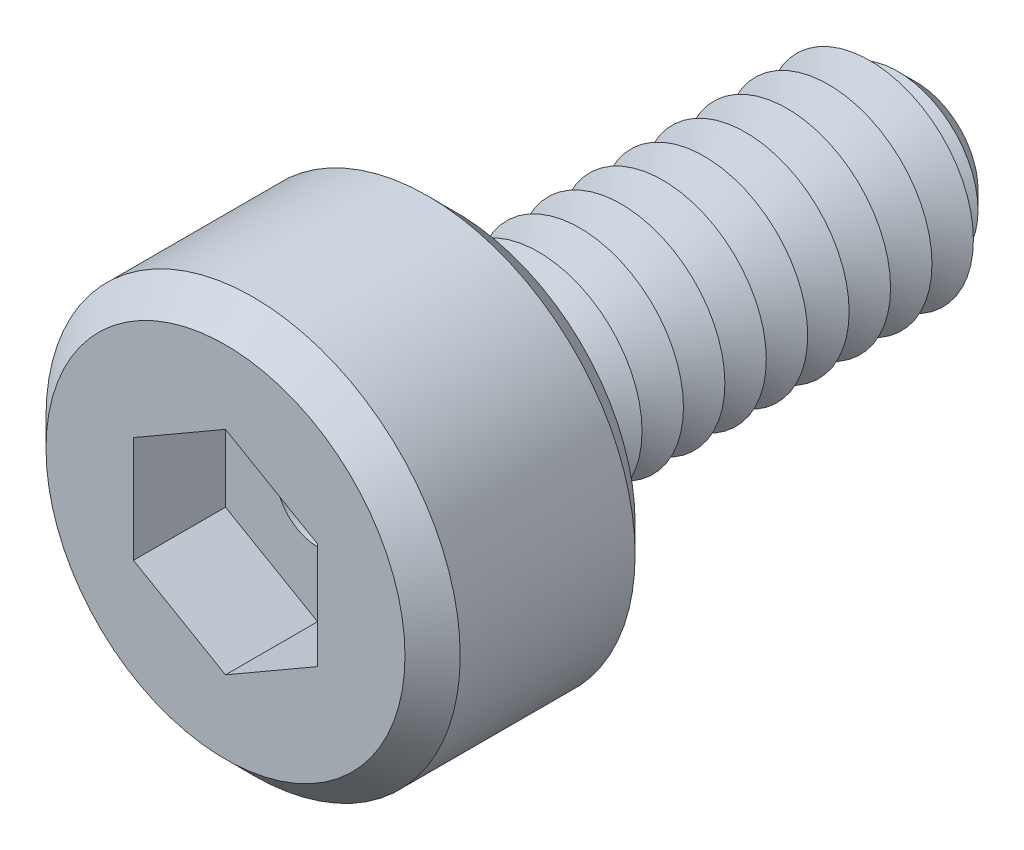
SolidWorks part; units mm, degrees
ref_plane "Front Plane" through (0, 0, 0) normal (0, 0, 1) x (1, 0, 0)
ref_plane "Top Plane" through (0, 0, 0) normal (0, 1, 0) x (1, 0, 0)
ref_plane "Right Plane" through (0, 0, 0) normal (1, 0, 0) x (0, 0, -1)
sketch "Sketch1" plane through (0, 0, 0) normal (0, 0, 1) x (1, 0, 0)
  circle A0 centre (0, 0) radius 2.25
  dimension "D1" = 4.5
extrude "Boss-Extrude1" add sketch "Sketch1" along normal blind 2.5
sketch "Sketch2" plane through (0, 0, 0) normal (0, 0, -1) x (-1, 0, 0)
  circle A0 centre (0, 0) radius 1.125
  dimension "D1" = 2.25
extrude "Boss-Extrude2" add sketch "Sketch2" along normal blind 5
chamfer "Chamfer1" distance 0.45 angle 45 1 edges at (-1.125, 0, -5)
sketch "Sketch3" plane through (0, 0, 0) normal (1, 0, 0) x (0, 0, -1)
  line L0 (-2.5121, 0) -> (4.5776, 0) construction
sketch "Sketch4" plane through (0, 0, 0) normal (1, 0, 0) x (0, 0, -1)
  line L0 (0, 1.125) -> (0.225, 0.7353)
  line L1 (0.225, 0.7353) -> (0.45, 1.125)
  line L2 (4.55, 1.125) -> (0, 1.125) construction
  line L3 (0.45, 1.125) -> (0, 1.125)
  dimension "D1" = 0.45
revolve "Cut-Revolve1" cut sketch "Sketch4" angle 360 about L0
pattern_linear "LPattern1" count 11 spacing 0.45 along (0, 0, -1) of "Cut-Revolve1"
sketch "Sketch5" plane through (0, 0, 2.5) normal (0, 0, 1) x (1, 0, 0)
  line L1 (0, 1.1547) -> (-1, 0.5774)
  line L2 (-1, 0.5774) -> (-1, -0.5774)
  line L3 (-1, -0.5774) -> (0, -1.1547)
  line L4 (0, -1.1547) -> (1, -0.5774)
  line L5 (1, -0.5774) -> (1, 0.5774)
  line L6 (1, 0.5774) -> (0, 1.1547)
  circle A0 centre (0, 0) radius 1 construction
  dimension "D1" = 2
extrude "Cut-Extrude1" cut sketch "Sketch5" against normal blind 1
sketch "Sketch6" plane through (0, 0, 1.5) normal (0, 0, 1) x (1, 0, 0)
  circle A0 centre (0, 0) radius 0.45
  dimension "D1" = 0.9
extrude "Cut-Extrude2" cut sketch "Sketch6" against normal up to surface (6.5 mm away)
chamfer "Chamfer2" distance 0.3 angle 45 2 edges at (2.25, 0, 0) (2.25, 0, 2.5)
